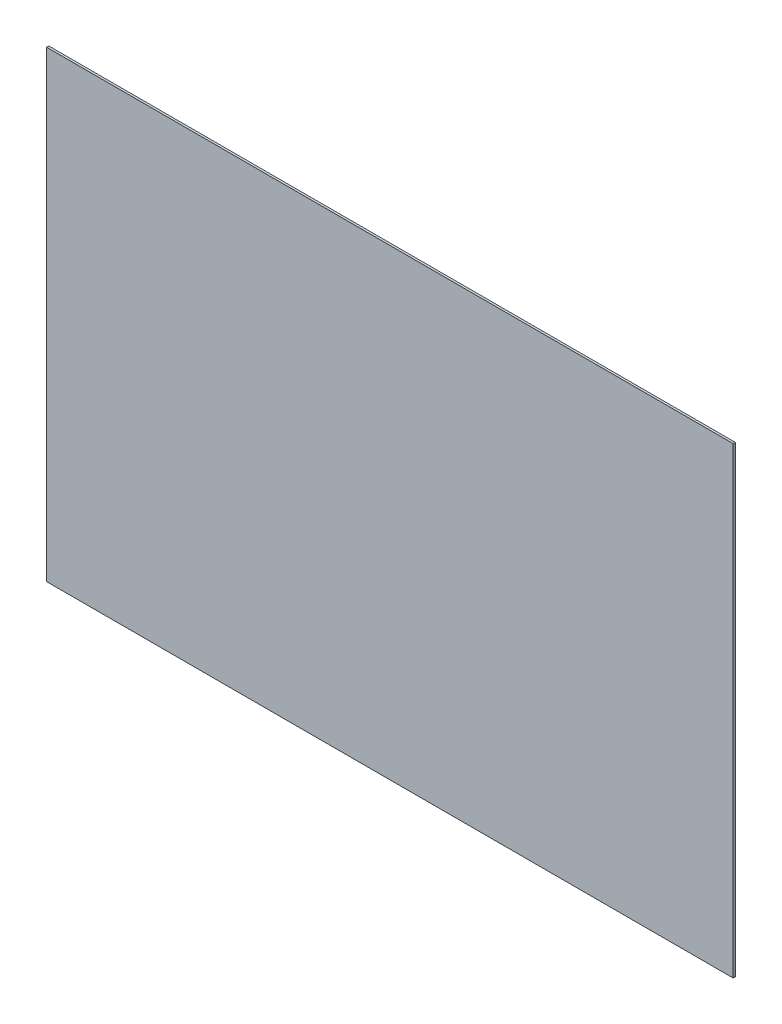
SolidWorks part; units mm, degrees
ref_plane "Alzado" through (0, 0, 0) normal (0, 0, 1) x (1, 0, 0)
ref_plane "Planta" through (0, 0, 0) normal (0, 1, 0) x (1, 0, 0)
ref_plane "Vista lateral" through (0, 0, 0) normal (1, 0, 0) x (0, 0, -1)
sketch "Croquis1" plane through (0, 0, 0) normal (0, 0, 1) x (1, 0, 0)
  line L1 (0, 0) -> (947, 0)
  line L2 (0, 0) -> (0, 638.5)
  line L3 (0, 638.5) -> (947, 638.5)
  line L4 (947, 0) -> (947, 638.5)
  dimension "D1" = 947
  dimension "D2" = 638.5
extrude "Saliente-Extruir1" add sketch "Croquis1" along normal blind 3
